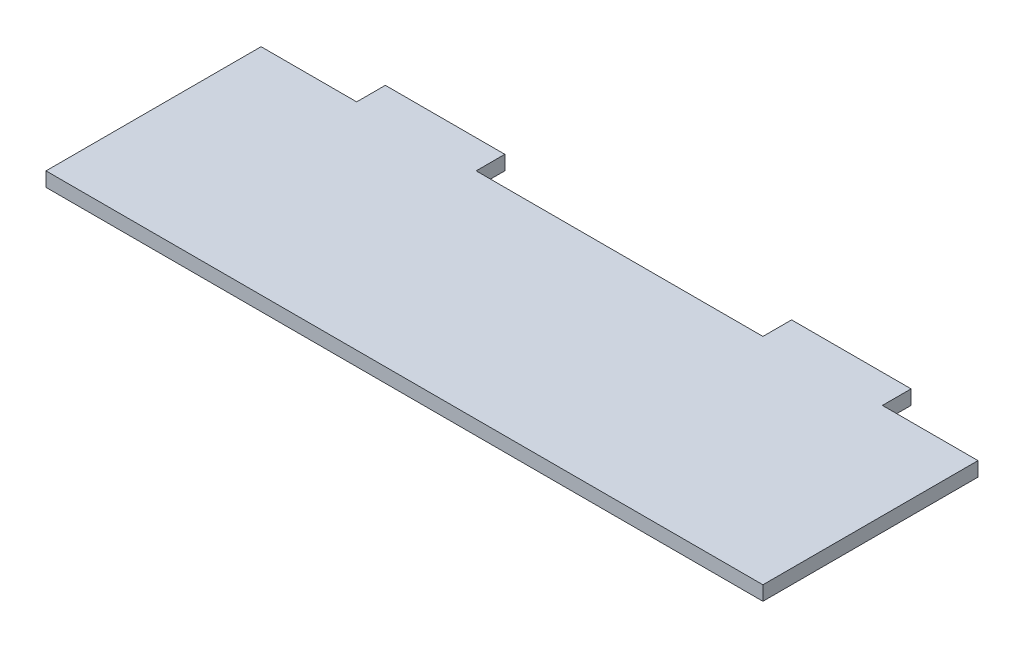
SolidWorks part; units mm, degrees
ref_plane "Front Plane" through (0, 0, 0) normal (0, 0, 1) x (1, 0, 0)
ref_plane "Top Plane" through (0, 0, 0) normal (0, 1, 0) x (1, 0, 0)
ref_plane "Right Plane" through (0, 0, 0) normal (1, 0, 0) x (0, 0, -1)
sketch "Sketch1" plane through (0, 0, 0) normal (0, 1, 0) x (1, 0, 0)
  line L0 (0, 0) -> (0, 19) construction
  line L1 (-75, 22.5) -> (-55, 22.5)
  line L2 (-75, 22.5) -> (-75, -22.5)
  line L3 (-75, -22.5) -> (75, -22.5)
  line L4 (75, 22.5) -> (75, -22.5)
  line L5 (-75, 22.5) -> (75, -22.5) construction
  line L6 (-75, -22.5) -> (75, 22.5) construction
  line L7 (55, 22.5) -> (75, 22.5)
  line L8 (-55, 22.5) -> (-55, 28.5)
  line L9 (-55, 28.5) -> (-30, 28.5)
  line L10 (-30, 22.5) -> (-30, 28.5)
  line L11 (30, 22.5) -> (30, 28.5)
  line L12 (55, 28.5) -> (30, 28.5)
  line L13 (55, 22.5) -> (55, 28.5)
  line L15 (-30, 22.5) -> (30, 22.5)
  point P0 (0, 0)
  dimension "D1" = 45
  dimension "D2" = 150
  dimension "D3" = 25
  dimension "D4" = 6
  dimension "D5" = 20
extrude "Boss-Extrude1" add sketch "Sketch1" along normal blind 3
equation "\"sheet thickness\"= 3mm"
equation "\"D1@Boss-Extrude1\"=\"sheet thickness\""
